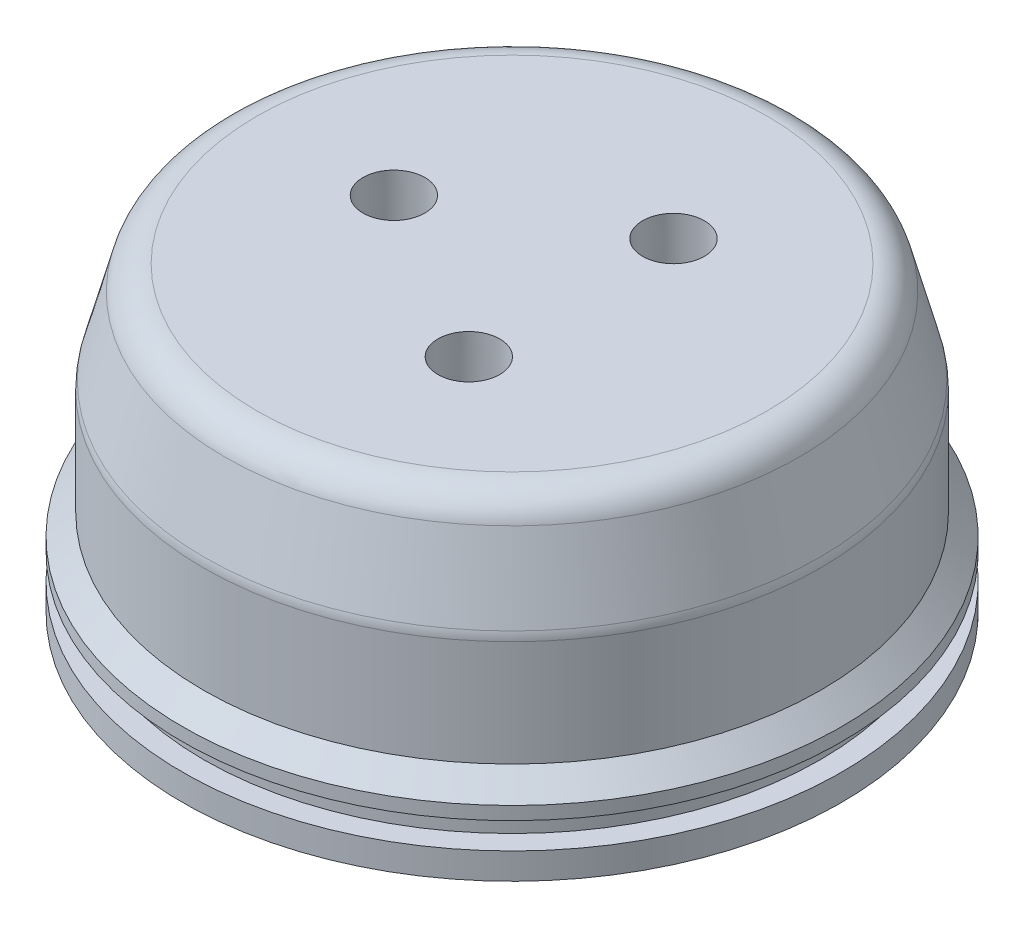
SolidWorks part; units mm, degrees
ref_plane "Front Plane" through (0, 0, 0) normal (0, 0, 1) x (1, 0, 0)
ref_plane "Top Plane" through (0, 0, 0) normal (0, 1, 0) x (1, 0, 0)
ref_plane "Right Plane" through (0, 0, 0) normal (1, 0, 0) x (0, 0, -1)
sketch "Sketch1" plane through (0, 0, 0) normal (0, 0, 1) x (1, 0, 0)
  line L0 (0, 0) -> (0, 79.4093) construction
  line L1 (-63.754, 0) -> (-63.754, 5.08)
  line L2 (-63.754, 10.16) -> (-59.6195, 10.16)
  line L3 (-59.6195, 10.16) -> (-59.6195, 5.08)
  line L4 (-59.6195, 5.08) -> (-63.754, 5.08)
  line L5 (-63.754, 10.16) -> (-63.754, 12.7)
  line L6 (-63.754, 12.7) -> (-59.69, 16.764)
  line L7 (-59.69, 16.764) -> (-59.69, 38.1)
  line L8 (-54.2453, 58.42) -> (0, 58.42)
  line L10 (-50.8, 0) -> (-50.8, 49.53)
  line L11 (-50.8, 49.53) -> (0, 49.53)
  line L12 (0, 49.53) -> (0, 58.42)
  line L14 (-59.69, 38.1) -> (-54.2453, 58.42)
  line L15 (-63.5, 13.3863) -> (-63.5, -12.7) construction
  line L16 (-50.8, 0) -> (-63.754, 0)
  dimension "D1" = 8.89
  dimension "D2" = 8.89
  dimension "D3" = 135
  dimension "D4" = 12.7
  dimension "D5" = 119.38
  dimension "D6" = 105
  dimension "D7" = 20.32
  dimension "D8" = 0.254
  dimension "D9" = 58.42
  dimension "D10" = 5.08
  dimension "D11" = 5.08
  dimension "D12" = 4.1345
revolve "Revolve1" add sketch "Sketch1" angle 360 about L0
hole_wizard "1/4 NPT Tapped Hole1" positions "Sketch3" profile "Sketch2" size "1/4" standard "ANSI Inch"
sketch "Sketch3" plane through (0, 49.53, 0) normal (0, -1, 0) x (-1, 0, 0)
  point P0 (22.86, 0)
  dimension "D1" = 22.86
sketch "Sketch2" plane through (-22.86, 49.53, 0) normal (1, 0, 0) x (0, 0, -1)
  line L0 (0, 0) -> (0, 8.89)
  line L1 (0, 8.89) -> (5.5626, 8.89)
  line L2 (-5.9437, 10.033) -> (-6.2441, 0) construction
  line L3 (5.5626, 8.89) -> (5.5626, 10.033)
  line L4 (5.5626, 10.033) -> (5.9437, 10.033)
  line L5 (5.9437, 10.033) -> (6.2441, 0)
  line L7 (6.2441, 0) -> (0, 0)
  line L8 (0, -6.35) -> (0, 107.95) construction
  line L11 (-5.5626, 10.033) -> (-5.9437, 10.033) construction
  dimension "Thru Tap Drill Dia." = 11.1252
  dimension "Thru Tap Drill Depth" = 8.89
  dimension "Thread Dia." = 12.4882
  dimension "Thread Angle" = 3.43
  dimension "Thread Depth" = 10.033
pattern_circular "CirPattern1" count 3 over 360 about axis through (0, 0, 0) along (0, 1, 0) of "1/4 NPT Tapped Hole1"
fillet "Fillet1" radius 6.35 3 edges at (0, 49.53, -50.8) (0, 58.42, -54.2453) (0, 38.1, -59.69)
sketch "Sketch4" plane through (0, 0, 0) normal (0, -1, 0) x (1, 0, 0)
  circle A0 centre (0, 7.62) radius 100.33
  dimension "D1" = 200.66
extrude "Boss-Extrude1" [suppressed] add sketch "Sketch4" along normal blind 6.35
fillet "Fillet2" [suppressed] radius 1.27
